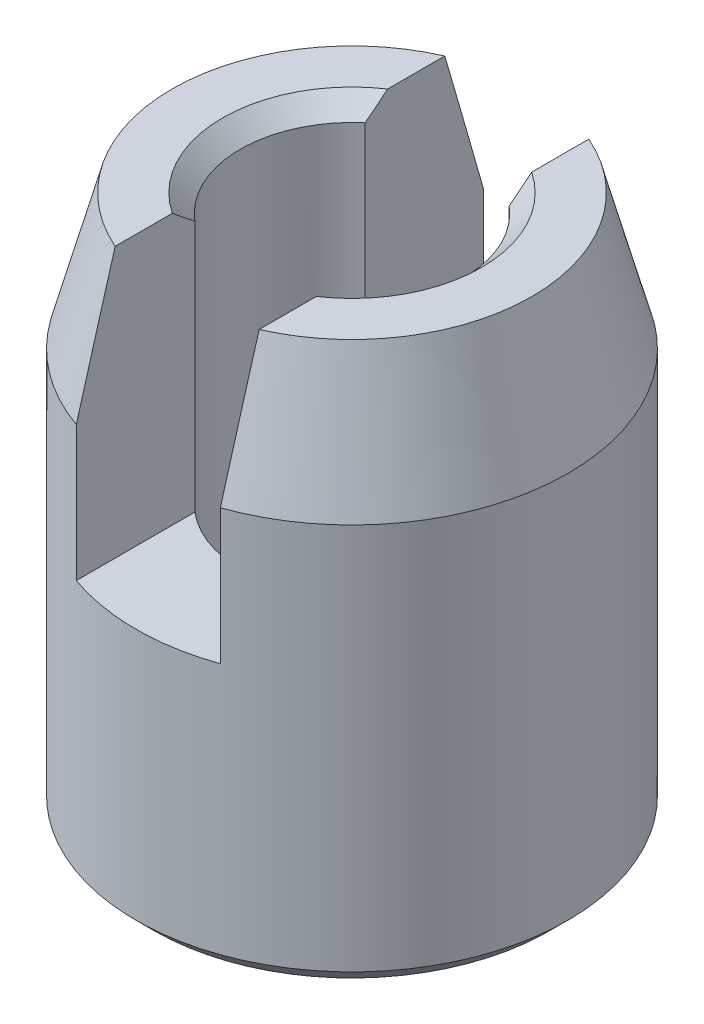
SolidWorks part; units mm, degrees
ref_plane "Vorne" through (0, 0, 0) normal (0, 0, 1) x (1, 0, 0)
ref_plane "Oben" through (0, 0, 0) normal (0, 1, 0) x (1, 0, 0)
ref_plane "Rechts" through (0, 0, 0) normal (1, 0, 0) x (0, 0, -1)
sketch "Skizze1" plane through (0, 0, 0) normal (0, 0, 1) x (1, 0, 0)
  line L0 (2.065, 0) -> (2.065, 10)
  line L1 (2.065, 10) -> (3.3301, 10)
  line L2 (3.3301, 10) -> (4, 7.5)
  line L3 (4, 7.5) -> (4, 0)
  line L4 (4, 0) -> (2.065, 0)
  line L5 (0, 0) -> (0, 9.3038) construction
  point P0 (2.065, 0)
  point P1 (2.065, 10)
  point P5 (4, 0)
  dimension "D1" = 4.13
  dimension "D2" = 8
  dimension "D3" = 15
  dimension "D4" = 10
  dimension "D5" = 2.5
revolve "Rotation1" add sketch "Skizze1" angle 360 about L5
chamfer "Fase1" distance 0.3333 angle 45 3 edges at (0, 0, -4) (0, 0, -2.065) (0, 10, -2.065)
sketch "Skizze2" plane through (0, 0, 0) normal (0, 0, 1) x (1, 0, 0)
  line L0 (3.3301, 10) -> (-3.3301, 10) construction
  line L1 (-1.3333, 10) -> (1.3333, 10)
  line L2 (-1.3333, 10) -> (-1.3333, 5)
  line L3 (-1.3333, 5) -> (1.3333, 5)
  line L4 (1.3333, 10) -> (1.3333, 5)
  line L6 (-2.3983, 0) -> (2.3983, 0) construction
  point P6 (0, 5)
  dimension "D1" = 2.6667
  dimension "D2" = 5
extrude "Schnitt-Linear austragen1" cut sketch "Skizze2" against normal through all and the other way through all
equation "\"D5@Skizze1\" = \"D4@Skizze1\" / 4"
equation "\"D1@Skizze2\" = \"D2@Skizze1\" / 3"
equation "\"D2@Skizze2\" = \"D4@Skizze1\" / 2"
equation "\"D1@Fase1\" = \"D2@Skizze1\" / 24"
